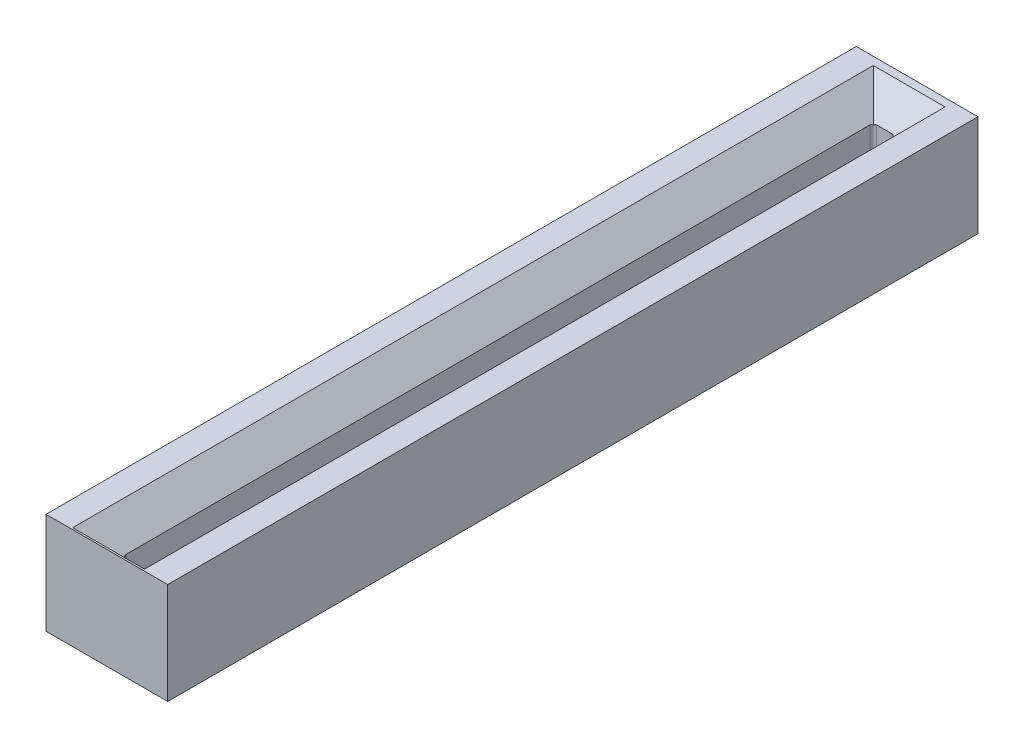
SolidWorks part; units mm, degrees
ref_plane "Front Plane" through (0, 0, 0) normal (1, 0, 0) x (0, 1, 0)
ref_plane "Top Plane" through (0, 0, 0) normal (0, 0, 1) x (0, 1, 0)
ref_plane "Right Plane" through (0, 0, 0) normal (0, 1, 0) x (-1, 0, 0)
sketch "beam" plane through (0, 0, 0) normal (0, 1, 0) x (-1, 0, 0)
  line L1 (-38.1, 1500) -> (38.1, 1500)
  line L2 (-38.1, 1500) -> (-38.1, -1500)
  line L3 (-38.1, -1500) -> (38.1, -1500)
  line L4 (38.1, 1500) -> (38.1, -1500)
  line L5 (-38.1, 1500) -> (38.1, -1500) construction
  line L6 (-38.1, -1500) -> (38.1, 1500) construction
  point P0 (0, 0)
  dimension "D1" = 3000
  dimension "D2" = 76.2
sketch "Sketch3" plane through (0, 0, 0) normal (0, 1, 0) x (-1, 0, 0)
  line L1 (-177.8, 1639.7) -> (177.8, 1639.7) construction
  line L2 (-177.8, 1639.7) -> (-177.8, -1639.7) construction
  line L3 (-177.8, -1639.7) -> (177.8, -1639.7) construction
  line L4 (177.8, 1639.7) -> (177.8, -1639.7) construction
  line L5 (-177.8, 1639.7) -> (177.8, -1639.7) construction
  line L6 (-177.8, -1639.7) -> (177.8, 1639.7) construction
  line L8 (-38.1, 1500) -> (38.1, 1500) construction
  line L9 (-38.1, 1500) -> (-38.1, -1500) construction
  circle A0 centre (-207.9625, 1669.8625) radius 30.1625
  circle A2 centre (207.9625, 1669.8625) radius 30.1625
  circle A3 centre (-207.9625, 1399.8625) radius 30.1625
  circle A4 centre (207.9625, 1399.8625) radius 30.1625
  circle A5 centre (-207.9625, 1129.8625) radius 30.1625
  circle A6 centre (207.9625, 1129.8625) radius 30.1625
  circle A7 centre (-207.9625, 859.8625) radius 30.1625
  circle A8 centre (207.9625, 859.8625) radius 30.1625
  circle A9 centre (-207.9625, 589.8625) radius 30.1625
  circle A10 centre (207.9625, 589.8625) radius 30.1625
  circle A11 centre (-207.9625, -1669.8625) radius 30.1625
  circle A12 centre (207.9625, -1669.8625) radius 30.1625
  circle A13 centre (-207.9625, -1399.8625) radius 30.1625
  circle A14 centre (207.9625, -1399.8625) radius 30.1625
  circle A15 centre (-207.9625, -1129.8625) radius 30.1625
  circle A16 centre (207.9625, -1129.8625) radius 30.1625
  circle A17 centre (-207.9625, -859.8625) radius 30.1625
  circle A18 centre (207.9625, -859.8625) radius 30.1625
  circle A19 centre (-207.9625, -589.8625) radius 30.1625
  circle A20 centre (207.9625, -589.8625) radius 30.1625
  circle A21 centre (-207.9625, -319.8625) radius 30.1625
  circle A22 centre (207.9625, -319.8625) radius 30.1625
  circle A25 centre (-207.9625, 319.8625) radius 30.1625
  circle A26 centre (207.9625, 319.8625) radius 30.1625
  point P2 (0, 0)
  dimension "D1" = 60.325
  dimension "D4" = 6
  dimension "D5" = 60.325
  dimension "D6" = 60.325
  dimension "D7" = 60.325
  dimension "D2" = 139.7
  dimension "D3" = 139.7
  dimension "D8" = 6
sketch "Sketch2" plane through (0, 0, 0) normal (0, 1, 0) x (-1, 0, 0)
  line L5 (-244.125, 1706.025) -> (244.125, 1706.025)
  line L6 (-244.125, 1706.025) -> (-244.125, -1706.025)
  line L7 (-244.125, -1706.025) -> (244.125, -1706.025)
  line L8 (44.1, 1506) -> (-44.1, 1506)
  line L9 (-44.1, 1506) -> (-44.1, -1506)
  line L10 (-44.1, -1506) -> (44.1, -1506)
  line L11 (44.1, -1506) -> (44.1, 1506)
  line L12 (44.1, 1506) -> (-44.1, 1506)
  line L13 (-44.1, 1506) -> (-44.1, -1506)
  line L14 (-44.1, -1506) -> (44.1, -1506)
  line L15 (44.1, -1506) -> (44.1, 1506)
  line L16 (244.125, 1706.025) -> (244.125, -1706.025)
  line L17 (-238.125, 1700.025) -> (238.125, 1700.025) construction
  line L18 (-238.125, 1700.025) -> (-238.125, -1700.025) construction
  line L19 (-238.125, -1700.025) -> (238.125, -1700.025) construction
  line L20 (238.125, 1700.025) -> (238.125, -1700.025) construction
  circle A0 centre (-207.9625, 1669.8625) radius 30.1625 construction
  circle A1 centre (-207.9625, 1399.8625) radius 30.1625 construction
  circle A2 centre (207.9625, 1669.8625) radius 30.1625 construction
  circle A3 centre (-207.9625, -1669.8625) radius 30.1625 construction
  dimension "D2" = 6
  dimension "D3" = 6
  dimension "D4" = 6
  dimension "D5" = 6
  dimension "D1" = 6
extrude "Boss-Extrude2" add sketch "Sketch2" along normal mid plane 406.4
chamfer "Chamfer1" distance 100 angle 45 8 edges at (44.1, 203.2, 0) (0, 203.2, -1506) (-44.1, 203.2, 0) (0, 203.2, 1506) (0, -203.2, -1506) (44.1, -203.2, 0) (-44.1, -203.2, 0) (0, -203.2, 1506)
fillet "Fillet1" radius 13 4 edges at (44.1, 0, 1506) (-44.1, 0, 1506) (-44.1, 0, -1506) (44.1, 0, -1506)
sketch "Sketch4" plane through (0, 0, 0) normal (0, 1, 0) x (-1, 0, 0)
  line L0 (144.1, -1606) -> (-144.1, -1606) construction
  line L1 (-335.4406, -1638) -> (480.8931, -1638)
  line L2 (-335.4406, -1638) -> (-335.4406, -2032.0014)
  line L3 (-335.4406, -2032.0014) -> (480.8931, -2032.0014)
  line L4 (480.8931, -1638) -> (480.8931, -2032.0014)
  line L5 (-144.1, 1606) -> (144.1, 1606) construction
  line L6 (-312.1487, 1760.6439) -> (297.5157, 1760.6439)
  line L7 (-312.1487, 1760.6439) -> (-312.1487, 1613)
  line L8 (-312.1487, 1613) -> (297.5157, 1613)
  line L9 (297.5157, 1760.6439) -> (297.5157, 1613)
  dimension "D1" = 1638
  dimension "D2" = 32
  dimension "D3" = 7
extrude "Cut-Extrude1" cut sketch "Sketch4" against normal through all both and the other way through all
